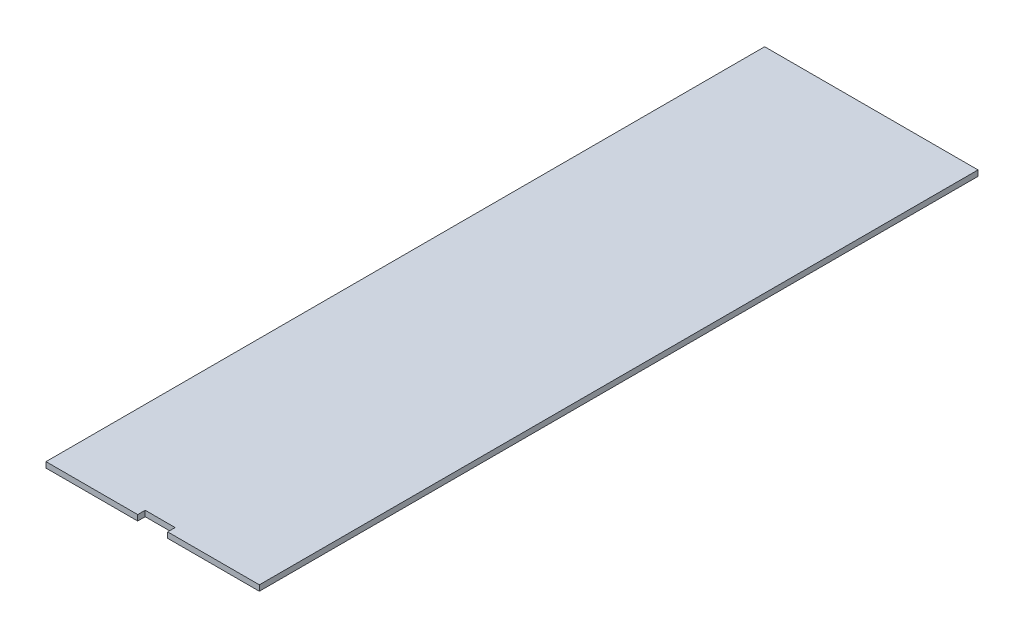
SolidWorks part; units mm, degrees
ref_plane "Front Plane" through (0, 0, 0) normal (0, 0, 1) x (1, 0, 0)
ref_plane "Top Plane" through (0, 0, 0) normal (0, 1, 0) x (1, 0, 0)
ref_plane "Right Plane" through (0, 0, 0) normal (1, 0, 0) x (0, 0, -1)
sketch "Sketch1" plane through (0, 0, 0) normal (0, 1, 0) x (1, 0, 0)
  line L0 (103.1875, 0) -> (180.975, 0)
  line L1 (0, 0) -> (77.7875, 0)
  line L2 (0, 0) -> (0, 609.6)
  line L3 (0, 609.6) -> (180.975, 609.6)
  line L4 (180.975, 0) -> (180.975, 609.6)
  line L5 (0, 6.35) -> (180.975, 6.35) construction
  line L6 (77.7875, 0) -> (77.7875, 6.35)
  line L7 (77.7875, 6.35) -> (103.1875, 6.35)
  line L8 (103.1875, 0) -> (103.1875, 6.35)
  point P9 (90.4875, 6.35)
  dimension "D1" = 180.975
  dimension "D2" = 609.6
  dimension "D3" = 25.4
  dimension "D4" = 180.975
  dimension "D5" = 6.35
extrude "Boss-Extrude1" add sketch "Sketch1" along normal blind 4.7625
sketch "Sketch2" plane through (0, 0, 0) normal (0, 0, 1) x (1, 0, 0)
  line L0 (0, 4.7625) -> (77.7875, 4.7625) construction
  line L1 (2.54, 4.445) -> (7.62, 4.445)
  line L2 (2.54, 4.445) -> (2.54, 0.3175)
  line L3 (2.54, 0.3175) -> (7.62, 0.3175)
  line L4 (7.62, 4.445) -> (7.62, 0.3175)
  line L5 (0, 0) -> (77.7875, 0) construction
  line L8 (0, 4.7625) -> (0, 0) construction
  dimension "D1" = 0.3175
  dimension "D2" = 0.3175
  dimension "D3" = 2.54
  dimension "D4" = 5.08
extrude "Cut-Extrude3" [suppressed] cut sketch "Sketch2" against normal through all
pattern_linear "LPattern1" [suppressed] count 33 spacing 5.3975 count 2 spacing 5.3975
